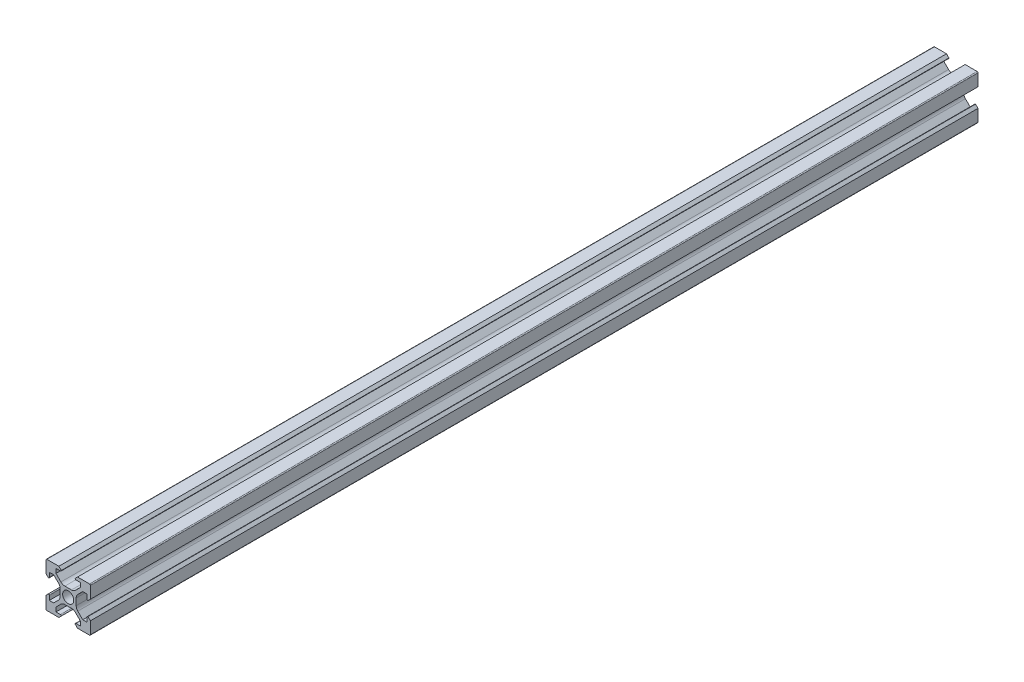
SolidWorks part; units mm, degrees
ref_plane "Plano frontal" through (0, 0, 0) normal (0, 0, 1) x (1, 0, 0)
ref_plane "Plano superior" through (0, 0, 0) normal (0, 1, 0) x (1, 0, 0)
ref_plane "Plano direito" through (0, 0, 0) normal (1, 0, 0) x (0, 0, -1)
sketch "Esboço1" plane through (0, 0, 0) normal (0, 0, 1) x (1, 0, 0)
  line L0 (-3.1, 8.9) -> (-4.2, 10)
  line L1 (-9.6, 10) -> (-4.2, 10)
  line L2 (-3.6, 1.5038) -> (-3.6, 0)
  line L3 (-8.5, 5.5) -> (-8.5, 3.5)
  line L4 (-6.5607, 5.5) -> (-4.3322, 3.2716)
  line L5 (-8.5, 5.5) -> (-6.5607, 5.5)
  line L6 (-10, 9.6) -> (-10, 4.2)
  line L7 (-8.9, 3.1) -> (-10, 4.2)
  line L8 (0, 3.6) -> (0, -3.6) construction
  line L9 (9.8828, -9.8828) -> (0, 0) construction
  line L10 (9.8828, 9.8828) -> (0, 0) construction
  line L11 (3.6, -1.5038) -> (3.6, 0)
  line L12 (8.5, -5.5) -> (8.5, -3.5)
  line L13 (-5.5, 8.5) -> (-5.5, 6.5607)
  line L14 (6.5607, -5.5) -> (4.3322, -3.2716)
  line L15 (8.5, -5.5) -> (6.5607, -5.5)
  line L16 (3.1, -8.9) -> (4.2, -10)
  line L17 (9.6, -10) -> (4.2, -10)
  line L18 (5.5, -8.5) -> (5.5, -6.5607)
  line L19 (-18.5, 8.5) -> (-18.5, -8.5) construction
  line L20 (5.5, -6.5607) -> (3.2716, -4.3322)
  line L21 (5.5, -8.5) -> (3.5, -8.5)
  line L22 (10, -9.6) -> (10, -4.2)
  line L23 (-9.8828, 9.8828) -> (0, 0) construction
  line L24 (8.9, -3.1) -> (10, -4.2)
  line L25 (-5.5, 6.5607) -> (-3.2716, 4.3322)
  line L26 (5.5, 8.5) -> (3.5, 8.5)
  line L27 (-20, 10) -> (-20, -10) construction
  line L28 (5.5, 6.5607) -> (3.2716, 4.3322)
  line L29 (5.5, 8.5) -> (5.5, 6.5607)
  line L30 (8.9, 3.1) -> (10, 4.2)
  line L31 (10, 9.6) -> (10, 4.2)
  line L32 (8.5, 5.5) -> (6.5607, 5.5)
  line L33 (-5.5, 8.5) -> (-3.5, 8.5)
  line L34 (6.5607, 5.5) -> (4.3322, 3.2716)
  line L35 (8.5, 5.5) -> (8.5, 3.5)
  line L36 (-20, 10) -> (0, 10) construction
  line L37 (3.6, 1.5038) -> (3.6, 0)
  line L38 (9.6, 10) -> (4.2, 10)
  line L39 (-18.5, 8.5) -> (-1.5, 8.5) construction
  line L40 (-1.5038, 3.6) -> (1.5038, 3.6)
  line L41 (3.1, 8.9) -> (4.2, 10)
  line L42 (-8.9, -3.1) -> (-10, -4.2)
  line L43 (-10, -9.6) -> (-10, -4.2)
  line L44 (-1.5038, -3.6) -> (1.5038, -3.6)
  line L45 (-5.5, -8.5) -> (-3.5, -8.5)
  line L46 (-5.5, -6.5607) -> (-3.2716, -4.3322)
  line L47 (-5.5, -8.5) -> (-5.5, -6.5607)
  line L48 (-9.6, -10) -> (-4.2, -10)
  line L49 (-3.1, -8.9) -> (-4.2, -10)
  line L50 (-8.5, -5.5) -> (-6.5607, -5.5)
  line L51 (-6.5607, -5.5) -> (-4.3322, -3.2716)
  line L52 (-8.5, -5.5) -> (-8.5, -3.5)
  line L53 (-3.6, -1.5038) -> (-3.6, 0)
  line L54 (0, 10) -> (0, -10) construction
  line L55 (-20, -10) -> (0, -10) construction
  line L56 (-9.8828, -9.8828) -> (0, 0) construction
  line L57 (-18.5, -8.5) -> (-1.5, -8.5) construction
  line L58 (-1.5, 8.5) -> (-1.5, -8.5) construction
  arc A0 (2.5, 0) -> (-2.5, 0) centre (0, 0) ccw
  arc A1 (-3.5, 8.5) -> (-3.1, 8.9) centre (-3.5, 8.9) ccw
  arc A2 (-9.6, 10) -> (-10, 9.6) centre (-9.6, 9.6) ccw
  arc A3 (-3.2716, 4.3322) -> (-1.5038, 3.6) centre (-1.5038, 6.1) ccw
  arc A4 (-4.3322, 3.2716) -> (-3.6, 1.5038) centre (-6.1, 1.5038) cw
  arc A5 (-8.5, 3.5) -> (-8.9, 3.1) centre (-8.9, 3.5) cw
  arc A6 (3.5, -8.5) -> (3.1, -8.9) centre (3.5, -8.9) ccw
  arc A7 (3.2716, -4.3322) -> (1.5038, -3.6) centre (1.5038, -6.1) ccw
  arc A8 (4.3322, -3.2716) -> (3.6, -1.5038) centre (6.1, -1.5038) cw
  arc A9 (10, -9.6) -> (9.6, -10) centre (9.6, -9.6) cw
  arc A10 (8.5, -3.5) -> (8.9, -3.1) centre (8.9, -3.5) cw
  arc A11 (8.5, 3.5) -> (8.9, 3.1) centre (8.9, 3.5) ccw
  arc A12 (4.3322, 3.2716) -> (3.6, 1.5038) centre (6.1, 1.5038) ccw
  arc A13 (3.2716, 4.3322) -> (1.5038, 3.6) centre (1.5038, 6.1) cw
  arc A14 (9.6, 10) -> (10, 9.6) centre (9.6, 9.6) cw
  arc A15 (3.5, 8.5) -> (3.1, 8.9) centre (3.5, 8.9) cw
  arc A16 (-2.5, 0) -> (2.5, 0) centre (0, 0) ccw
  arc A17 (-8.5, -3.5) -> (-8.9, -3.1) centre (-8.9, -3.5) ccw
  arc A18 (-10, -9.6) -> (-9.6, -10) centre (-9.6, -9.6) ccw
  arc A19 (-4.3322, -3.2716) -> (-3.6, -1.5038) centre (-6.1, -1.5038) ccw
  arc A20 (-3.2716, -4.3322) -> (-1.5038, -3.6) centre (-1.5038, -6.1) cw
  arc A21 (-3.5, -8.5) -> (-3.1, -8.9) centre (-3.5, -8.9) cw
  point P103 (0, 0)
  dimension "D1" = 45
  dimension "D3" = 20
  dimension "D2" = 0.4
extrude "Ressalto-extrusão1" add sketch "Esboço1" along normal mid plane 400
